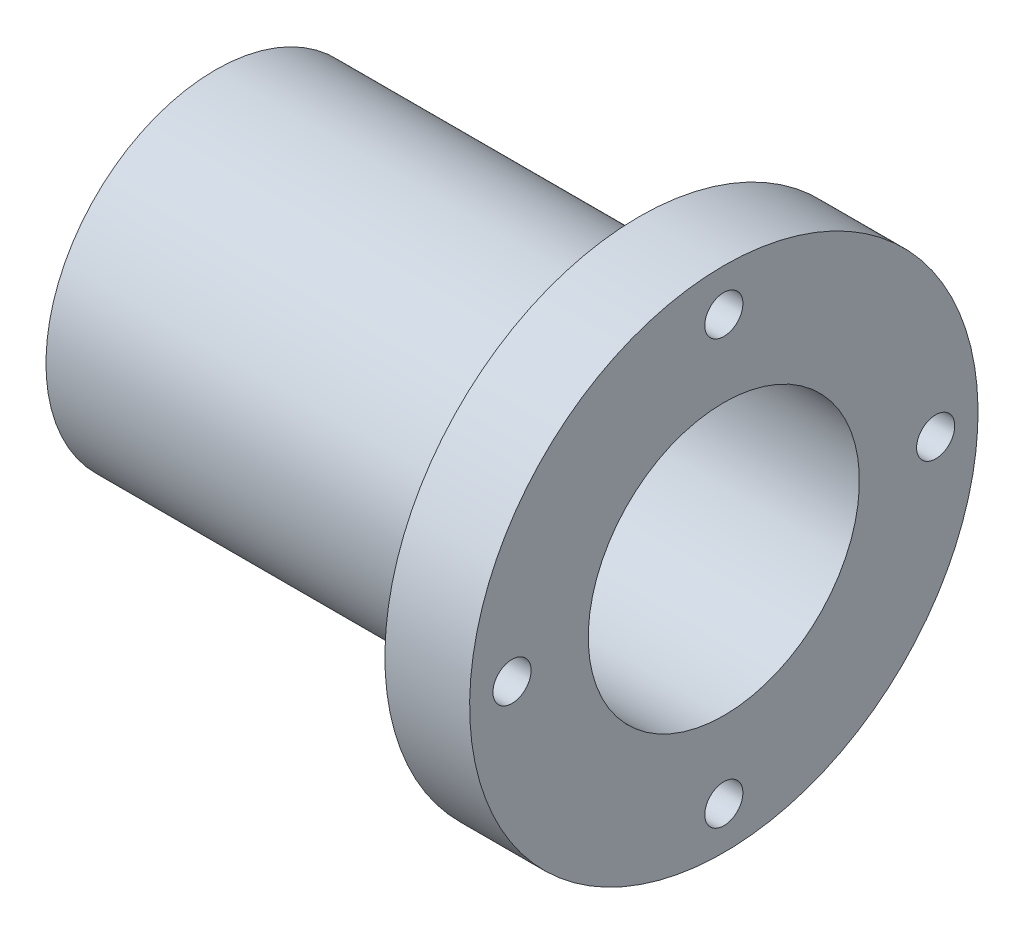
SolidWorks part; units mm, degrees
ref_plane "前基準面" through (0, 0, 0) normal (0, 0, 1) x (1, 0, 0)
ref_plane "上基準面" through (0, 0, 0) normal (0, 1, 0) x (1, 0, 0)
ref_plane "右基準面" through (0, 0, 0) normal (1, 0, 0) x (0, 0, -1)
sketch "草圖1" plane through (0, 0, 0) normal (0, 0, 1) x (1, 0, 0)
  line L0 (0, 0) -> (50, 0)
  line L1 (50, 0) -> (50, 10)
  line L2 (50, 10) -> (60, 10)
  line L3 (60, 10) -> (60, -20)
  line L4 (60, -20) -> (0, -20)
  line L5 (0, -20) -> (0, 0)
  dimension "D1" = 60
  dimension "D2" = 10
  dimension "D3" = 20
  dimension "D4" = 30
revolve "旋轉1" add sketch "草圖1" angle 360 about L4
sketch "草圖2" plane through (0, 0, 0) normal (-1, 0, 0) x (0, 0, 1)
  circle A0 centre (0, -20) radius 16
  dimension "D1" = 32
extrude "除料-伸長1" cut sketch "草圖2" against normal through all
hole_wizard "M4 六角承窩頭蓋螺釘的柱孔1" positions "草圖6" profile "草圖5" counterbore size "M4" standard "ISO"
sketch "草圖6" plane through (50, 0, 0) normal (-1, 0, 0) x (0, 0, 1)
  circle A0 centre (0, -20) radius 16 construction
  point P0 (0, 5)
  dimension "D1" = 25
sketch "草圖5" plane through (50, 5, 0) normal (0, 1, 0) x (0, 0, 1)
  line L0 (0, 0) -> (0, 10)
  line L1 (0, 10) -> (2.25, 10)
  line L3 (2.25, 10) -> (2.25, 4)
  line L4 (2.25, 4) -> (4, 4)
  line L5 (4, 4) -> (4, 0)
  line L7 (4, 0) -> (0, 0)
  line L11 (0, -6.35) -> (0, 107.95) construction
  dimension "貫穿孔直徑" = 4.5
  dimension "貫穿孔深度" = 10
  dimension "柱孔直徑" = 8
  dimension "柱孔深度" = 4
pattern_circular "環狀複製排列1" count 4 over 360 about axis through (0, -20, 0) along (1, 0, 0) of "M4 六角承窩頭蓋螺釘的柱孔1"
